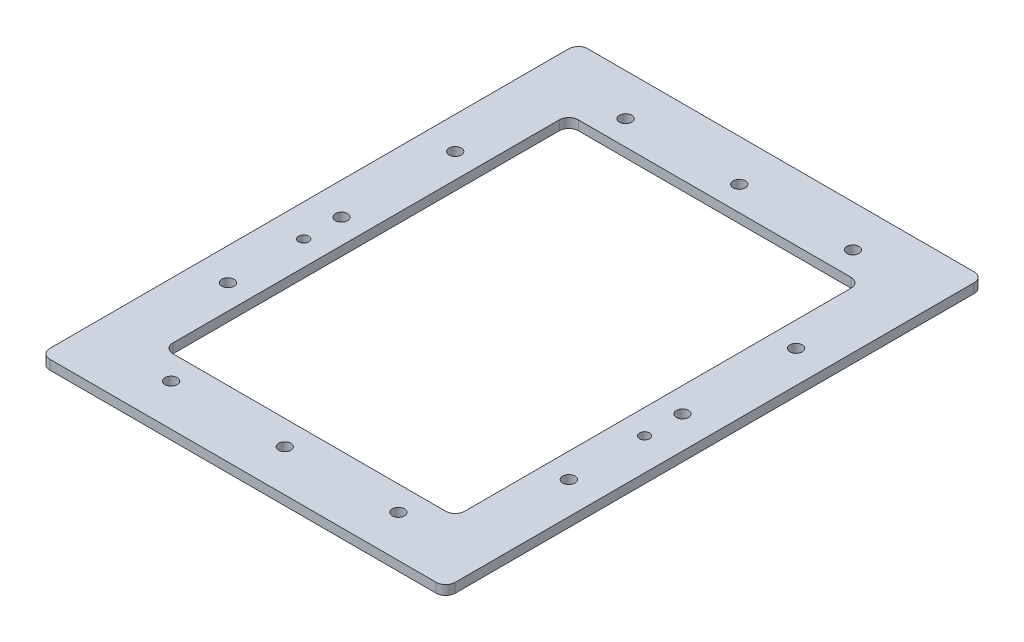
SolidWorks part; units mm, degrees
ref_plane "Front" through (0, 0, 0) normal (0, 0, 1) x (1, 0, 0)
ref_plane "Top" through (0, 0, 0) normal (0, 1, 0) x (1, 0, 0)
ref_plane "Right" through (0, 0, 0) normal (1, 0, 0) x (0, 0, -1)
sketch "Sketch1" plane through (0, 0, 0) normal (0, 1, 0) x (1, 0, 0)
  line L1 (-135.89, -180.34) -> (135.89, -180.34)
  line L2 (-135.89, -180.34) -> (-135.89, 180.34)
  line L3 (-135.89, 180.34) -> (135.89, 180.34)
  line L4 (135.89, -180.34) -> (135.89, 180.34)
  line L5 (0, 180.34) -> (0, -180.34) construction
  line L6 (-135.89, 0) -> (135.89, 0) construction
  line L7 (-97.79, -135.89) -> (97.79, -135.89)
  line L8 (-97.79, -135.89) -> (-97.79, 135.89)
  line L9 (-97.79, 135.89) -> (97.79, 135.89)
  line L10 (97.79, -135.89) -> (97.79, 135.89)
  line L11 (0, 135.89) -> (0, -135.89) construction
  line L12 (-97.79, 0) -> (97.79, 0) construction
  circle A0 centre (0, 0) radius 226.06 construction
  arc A1 (-135.89, 167.64) -> (-123.19, 180.34) centre (-123.19, 167.64) cw construction
  point P0 (0, 0)
  point P4 (0, 0)
  dimension "D5" = 452.12
  dimension "D6" = 12.7
  dimension "D1" = 360.68
  dimension "D2" = 271.78
  dimension "D3" = 44.45
  dimension "D4" = 38.1
extrude "Boss-Extrude1" add sketch "Sketch1" against normal blind 6.35
fillet "Fillet1" radius 6.35 8 edges at (-135.89, -3.175, 180.34) (135.89, -3.175, 180.34) (135.89, -3.175, -180.34) (-135.89, -3.175, -180.34) (97.79, -3.175, 135.89) (-97.79, -3.175, 135.89) (-97.79, -3.175, -135.89) (97.79, -3.175, -135.89)
sketch "Sketch2" plane through (0, 0, 0) normal (0, 1, 0) x (1, 0, 0)
  line L1 (-114.3, 152.4) -> (114.3, 152.4) construction
  line L2 (-114.3, 152.4) -> (-114.3, -152.4) construction
  line L3 (-114.3, -152.4) -> (114.3, -152.4) construction
  line L4 (114.3, 152.4) -> (114.3, -152.4) construction
  point P4 (114.3, 0)
  point P5 (0, 152.4)
  point P6 (-38.1, 152.4)
  point P8 (38.1, 152.4)
  point P9 (-76.2, 152.4)
  point P10 (76.2, 152.4)
  point P11 (114.3, 152.4)
  point P12 (114.3, 114.3)
  point P13 (114.3, 76.2)
  point P14 (114.3, 38.1)
  point P15 (114.3, -38.1)
  point P16 (114.3, -76.2)
  point P17 (114.3, -114.3)
  point P18 (-76.2, -152.4)
  point P19 (-38.1, -152.4)
  point P20 (38.1, -152.4)
  point P21 (76.2, -152.4)
  point P22 (-114.3, -76.2)
  point P23 (-114.3, -38.1)
  point P24 (-114.3, 38.1)
  point P25 (-114.3, 76.2)
  point P26 (-114.3, -114.3)
  point P27 (-114.3, 114.3)
  point P28 (-114.3, -25.4)
  point P29 (114.3, -25.4)
  point P30 (0, -152.4)
  point P34 (-114.3, 0)
hole_wizard "5/16 Clearance Hole1" positions "Sketch3" profile "Sketch4" hole size "5/16" standard "ANSI Inch"
sketch "Sketch3" plane through (0, 0, 0) normal (0, 1, 0) x (1, 0, 0)
  line L0 (-114.3, 152.4) -> (-114.3, -152.4) construction
  point P0 (-76.2, 152.4)
  point P3 (76.2, 152.4)
  point P14 (0, 152.4)
  point P17 (114.3, 0)
  point P20 (114.3, 76.2)
  point P23 (114.3, -76.2)
  point P26 (-114.3, 0)
  point P30 (-114.3, 76.2)
  point P33 (-114.3, -76.2)
  point P37 (0, -152.4)
  point P40 (-76.2, -152.4)
  point P43 (76.2, -152.4)
sketch "Sketch4" plane through (-76.2, 0, -152.4) normal (1, 0, 0) x (0, 0, 1)
  line L0 (0, 0) -> (0, 6.35)
  line L1 (0, 6.35) -> (4.1021, 6.35)
  line L2 (4.1021, 6.35) -> (4.1021, 0)
  line L5 (4.1021, 0) -> (0, 0)
  line L11 (0, -6.35) -> (0, 107.95) construction
  dimension "Thru Hole Dia." = 8.2042
  dimension "Thru Hole Depth" = 6.35
hole_wizard "1/4 Clearance Hole1" positions "Sketch5" profile "Sketch6" hole size "1/4" standard "ANSI Inch"
sketch "Sketch5" plane through (0, 0, 0) normal (0, 1, 0) x (1, 0, 0)
  point P0 (-114.3, -25.4)
  point P3 (114.3, -25.4)
sketch "Sketch6" plane through (-114.3, 0, 25.4) normal (1, 0, 0) x (0, 0, 1)
  line L0 (0, 0) -> (0, 6.35)
  line L1 (0, 6.35) -> (3.3782, 6.35)
  line L2 (3.3782, 6.35) -> (3.3782, 0)
  line L5 (3.3782, 0) -> (0, 0)
  line L11 (0, -6.35) -> (0, 107.95) construction
  dimension "Thru Hole Dia." = 6.7564
  dimension "Thru Hole Depth" = 6.35
equation "\"var\"= 1in"
equation "\"D4@Sketch2\"=\"D3@Sketch2\""
equation "\"D5@Sketch2\"=\"D3@Sketch2\""
equation "\"D6@Sketch2\"=\"D3@Sketch2\""
equation "\"D7@Sketch2\"=\"D3@Sketch2\""
equation "\"D8@Sketch2\"=\"D3@Sketch2\""
equation "\"D9@Sketch2\"=\"D3@Sketch2\""
equation "\"D10@Sketch2\"=\"D3@Sketch2\""
equation "\"D11@Sketch2\"=\"D3@Sketch2\""
equation "\"D12@Sketch2\"=\"D3@Sketch2\""
equation "\"D13@Sketch2\"=\"D3@Sketch2\""
